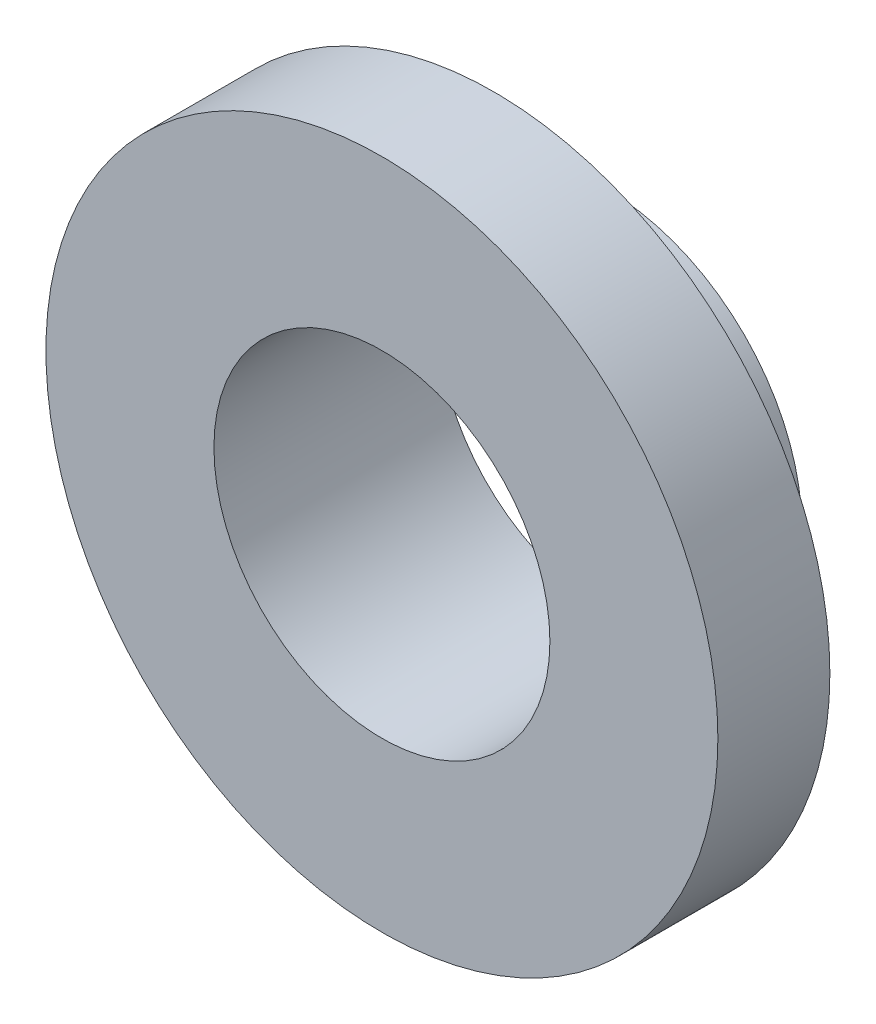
SolidWorks part; units mm, degrees
ref_plane "Спереди" through (0, 0, 0) normal (0, 0, 1) x (1, 0, 0)
ref_plane "Сверху" through (0, 0, 0) normal (0, 1, 0) x (1, 0, 0)
ref_plane "Справа" through (0, 0, 0) normal (1, 0, 0) x (0, 0, -1)
sketch "Эскиз1" plane through (0, 0, 0) normal (0, 0, 1) x (1, 0, 0)
  circle A0 centre (0, 0) radius 3
extrude "Бобышка-Вытянуть1" add sketch "Эскиз1" along normal blind 1
sketch "Эскиз2" plane through (0, 0, 0) normal (0, 0, -1) x (-1, 0, 0)
  circle A0 centre (0, 0) radius 1.75
extrude "Бобышка-Вытянуть2" add sketch "Эскиз2" along normal blind 1
sketch "Эскиз3" plane through (0, 0, -1) normal (0, 0, -1) x (-1, 0, 0)
  circle A0 centre (0, 0) radius 1.5
extrude "Вырез-Вытянуть1" cut sketch "Эскиз3" against normal up to surface (2 mm away)
